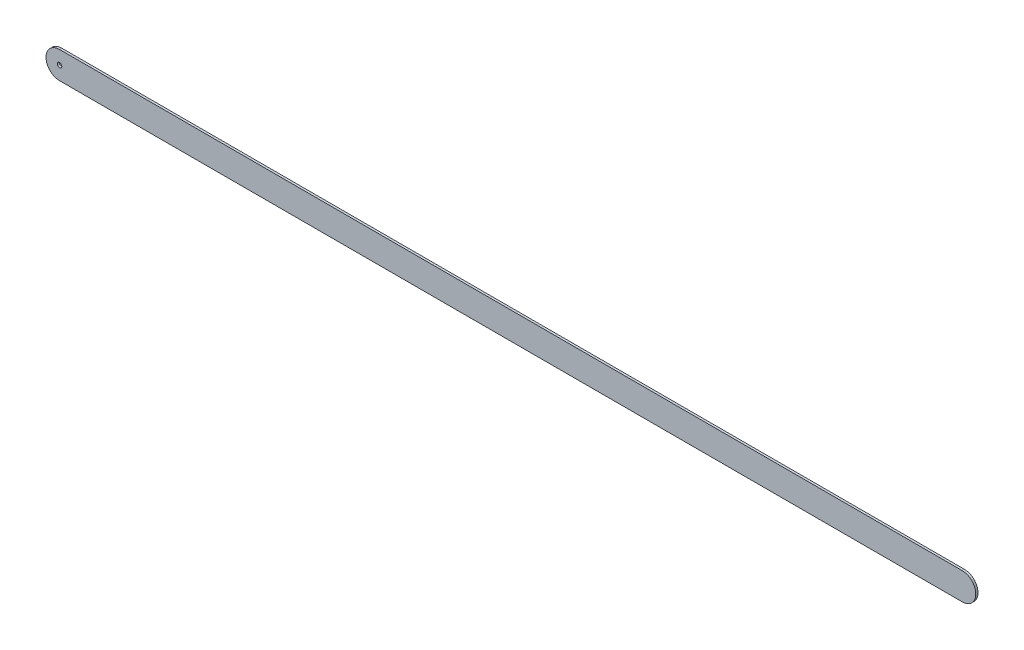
SolidWorks part; units mm, degrees
ref_plane "Front Plane" through (0, 0, 0) normal (0, 0, 1) x (1, 0, 0)
ref_plane "Top Plane" through (0, 0, 0) normal (0, 1, 0) x (1, 0, 0)
ref_plane "Right Plane" through (0, 0, 0) normal (1, 0, 0) x (0, 0, -1)
sketch "Sketch1" plane through (0, 0, 0) normal (0, 0, 1) x (1, 0, 0)
  line L0 (0, 0) -> (400, 0) construction
  line L1 (0.55, 0) -> (-0.55, 0) construction
  line L2 (0, 6) -> (400, 6)
  line L3 (0, -6) -> (400, -6)
  arc A0 (0, 6) -> (0, -6) centre (0, 0) ccw
  arc A1 (400, -6) -> (400, 6) centre (400, 0) ccw
  circle A2 centre (0, 0) radius 1
  point P5 (200, 0)
  dimension "D2" = 6
  dimension "D3" = 2
  dimension "D1" = 400
extrude "Boss-Extrude1" add sketch "Sketch1" along normal blind 1
